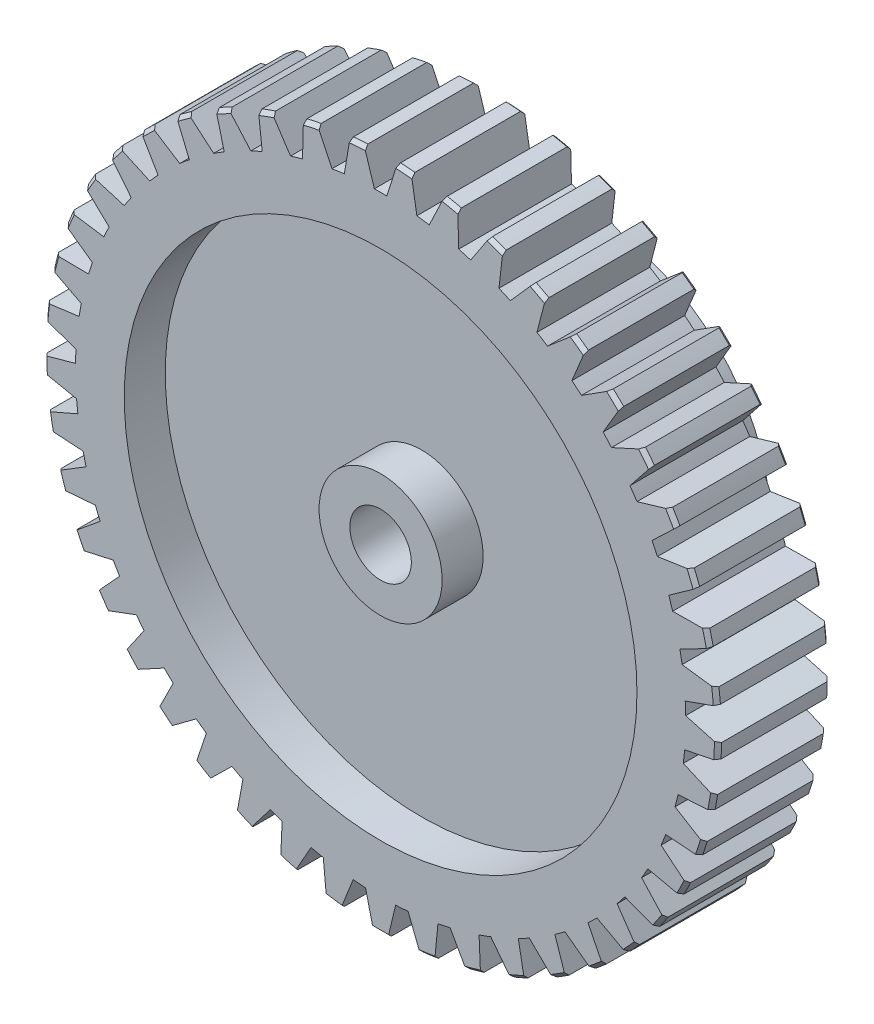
SolidWorks part; units mm, degrees
ref_plane "Plan1" through (0, 0, 0) normal (0, 0, 1) x (1, 0, 0)
ref_plane "Plan2" through (0, 0, 0) normal (0, 1, 0) x (1, 0, 0)
ref_plane "Plan3" through (0, 0, 0) normal (1, 0, 0) x (0, 0, -1)
sketch "Diamètre primitif" plane through (0, 0, 0) normal (0, 0, 1) x (1, 0, 0)
  line L0 (0, 0) -> (0.7, 0) construction
  circle A0 centre (0, 0) radius 15.75
  point P3 (0, 0)
  dimension "D1" = 31.5
  dimension "D2" = 0.7
sketch "Esquisse2" plane through (0, 0, 0) normal (0, 0, 1) x (1, 0, 0)
  circle A0 centre (0, 0) radius 16.45
  dimension "D1" = 32.9
extrude "Diamètre de tête" add sketch "Esquisse2" along normal mid plane 5.5
chamfer "Chanfreins" distance 0.175 angle 45
sketch "Esquisse3" plane through (0, 0, 0) normal (0, 0, 1) x (1, 0, 0)
  line L0 (0, 0) -> (0, 16.45) construction
  line L1 (-0.304, 14.8719) -> (-0.7955, 16.4308)
  line L2 (0.304, 14.8719) -> (0.7955, 16.4308)
  arc A0 (0.304, 14.8719) -> (-0.304, 14.8719) centre (0, 0) ccw
  circle A1 centre (0, 0) radius 16.45 construction
  arc A2 (0.7955, 16.4308) -> (-0.7955, 16.4308) centre (0, 0) ccw
  point P1 (-0.5498, 15.6513)
  point P10 (0.5498, 15.6513)
  dimension "D1" = 29.75
  dimension "D2" = 1.0996
  dimension "D3" = 325
extrude "Creux dent" cut sketch "Esquisse3" against normal through all and the other way through all
pattern_circular "Répétition" count 45 over 360
sketch "Esquisse4" plane through (0, 0, 2.75) normal (0, 0, 1) x (1, 0, 0)
  circle A0 centre (0, 0) radius 1.5
  dimension "D1" = 3
extrude "Passage axe" cut sketch "Esquisse4" against normal through all
sketch "Esquisse5" plane through (0, 0, 2.75) normal (0, 0, 1) x (1, 0, 0)
  circle A0 centre (0, 0) radius 3
  circle A1 centre (0, 0) radius 12.5
  dimension "D1" = 6
  dimension "D2" = 25
extrude "Gorge avant" cut sketch "Esquisse5" against normal blind 2
sketch "Esquisse6" plane through (0, 0, -2.75) normal (0, 0, -1) x (-1, 0, 0)
  circle A0 centre (0, 0) radius 12.5
  circle A1 centre (0, 0) radius 8.5
  dimension "D1" = 25
  dimension "D2" = 17
extrude "Gorge arrière" cut sketch "Esquisse6" against normal blind 1.5
sketch "Esquisse7" plane through (0, 0, -2.75) normal (0, 0, -1) x (-1, 0, 0)
  line L0 (5, 0) -> (0, 0) construction
  line L1 (-5, 5) -> (5, 5)
  line L2 (-5, 5) -> (-5, -5)
  line L3 (-5, -5) -> (5, -5)
  line L4 (5, 5) -> (5, -5)
  line L5 (0, 0) -> (0, -5) construction
  circle A1 centre (0, 0) radius 8.5
  circle A2 centre (0, 0) radius 8.5
  dimension "D2" = 10
  dimension "D1" = 0
extrude "Carré" add sketch "Esquisse7" along normal blind 5
equation "\"D1@Esquisse2\" = \"D1@Diamètre primitif\" + 2 * \"D2@Diamètre primitif\""
equation "\"D1@Chanfreins\" = 0.25*\"D2@Diamètre primitif\""
equation "\"D1@Esquisse3\" = \"D1@Diamètre primitif\"-2.5*\"D2@Diamètre primitif\""
equation "\"D2@Esquisse3\"=3.14159*\"D2@Diamètre primitif\"/2"
equation "\"D1@Répétition\" = \"D1@Diamètre primitif\"/\"D2@Diamètre primitif\""
